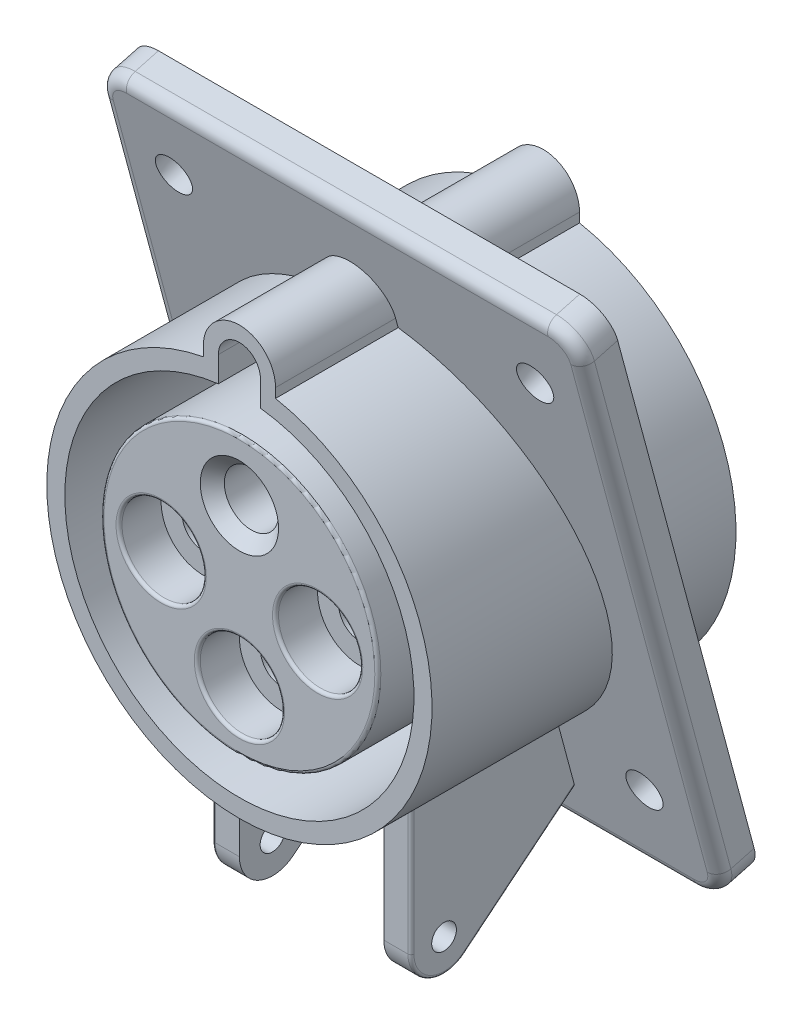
SolidWorks part; units mm, degrees
ref_plane "Спереди" through (0, 0, 0) normal (0, 0, 1) x (1, 0, 0)
ref_plane "Сверху" through (0, 0, 0) normal (0, 1, 0) x (1, 0, 0)
ref_plane "Справа" through (0, 0, 0) normal (1, 0, 0) x (0, 0, -1)
sketch "Эскиз1" plane through (0, 0, 0) normal (0, 0, 1) x (1, 0, 0)
  circle A0 centre (0, 0) radius 32
  dimension "D1" = 64
extrude "Бобышка-Вытянуть1" add sketch "Эскиз1" along normal blind 52
sketch "Эскиз2" plane through (0, 0, 52) normal (0, 0, 1) x (1, 0, 0)
  circle A0 centre (0, 0) radius 29
  dimension "D1" = 58
extrude "Вырез-Вытянуть1" cut sketch "Эскиз2" against normal blind 46
sketch "Эскиз3" plane through (0, 0, 0) normal (0, 0, -1) x (-1, 0, 0)
  circle A0 centre (0, 0) radius 24
  dimension "D1" = 48
extrude "Вырез-Вытянуть2" cut sketch "Эскиз3" against normal blind 46
sketch "Эскиз4" plane through (0, 0, 0) normal (0, 0, -1) x (-1, 0, 0)
  circle A0 centre (0, 0) radius 26
  circle A1 centre (0, 0) radius 48.7983
  dimension "D1" = 52
extrude "Вырез-Вытянуть3" cut sketch "Эскиз4" against normal blind 1.5
sketch "Эскиз5" plane through (0, 0, 52) normal (0, 0, 1) x (1, 0, 0)
  line L1 (-6, 33) -> (-6, 30.5387)
  line L2 (-6, 30.5387) -> (6, 30.5387)
  line L3 (6, 30.5387) -> (6, 33)
  arc A1 (6, 33) -> (-6, 33) centre (0, 33) ccw
  dimension "D1" = 12
extrude "Бобышка-Вытянуть2" add sketch "Эскиз5" against normal up to surface (50.5 mm away)
sketch "Эскиз6" plane through (0, 0, 52) normal (0, 0, 1) x (1, 0, 0)
  line L0 (-3.4963, 33) -> (-3.4963, 27.1224)
  line L1 (-3.4963, 27.1224) -> (3.4963, 27.1224)
  line L2 (3.4963, 27.1224) -> (3.4963, 33)
  arc A0 (3.4963, 33) -> (-3.4963, 33) centre (0, 33) ccw
extrude "Вырез-Вытянуть4" cut sketch "Эскиз6" against normal up to surface (46 mm away)
sketch "Эскиз7" plane through (0, 0, 0) normal (1, 0, 0) x (0, 0, -1)
  line L0 (-36.2467, 48.6283) -> (-30.4521, 50.1848)
  line L1 (-10.9858, -45.4163) -> (-5.1912, -43.8598)
  line L3 (-36.2467, 48.6283) -> (-10.9858, -45.4163)
  line L8 (-30.4521, 50.1848) -> (-5.1912, -43.8598)
extrude "Бобышка-Вытянуть3" add sketch "Эскиз7" along normal blind 40 and the other way blind 40
fillet "Скругление1" radius 5 4 edges at (40, -44.6381, 8.0885) (40, 49.4065, 33.3494) (-40, 49.4065, 33.3494) (-40, -44.6381, 8.0885)
sketch "Эскиз8" plane through (0, 0, 52) normal (0, 0, 1) x (1, 0, 0)
  line L0 (-3.4963, 33) -> (-3.4963, 28.7885)
  line L1 (3.4963, 33) -> (3.4963, 28.7885)
  arc A0 (-3.4963, 28.7885) -> (3.4963, 28.7885) centre (0, 0) ccw
  arc A1 (3.4963, 33) -> (-3.4963, 33) centre (0, 33) ccw
extrude "Вырез-Вытянуть5" cut sketch "Эскиз8" against normal blind 45
fillet "Скругление2" radius 2 8 edges at (-38.5355, 47.214, 35.8668) (0, 48.6283, 36.2467) (38.5355, 47.214, 35.8668) (40, 1.606, 23.6163) (38.5355, -44.002, 11.3657) (0, -45.4163, 10.9858) (-38.5355, -44.002, 11.3657) (-40, 1.606, 23.6163)
sketch "Эскиз9" plane through (0, -5.8085, 21.6247) normal (0, -0.2594, 0.9658) x (1, 0, 0)
  circle A0 centre (30, 43.3512) radius 3
  circle A1 centre (-30, 43.3512) radius 3
  circle A2 centre (-30, -26.6488) radius 3
  circle A3 centre (30, -26.6488) radius 3
extrude "Вырез-Вытянуть6" cut sketch "Эскиз9" against normal blind 40 draft 4
sketch "Эскиз10" plane through (0, 0, 1.5) normal (0, 0, -1) x (-1, 0, 0)
  circle A0 centre (0, 0) radius 23
extrude "Бобышка-Вытянуть4" add sketch "Эскиз10" against normal up to surface (50.5 mm away) separate body
sketch "Эскиз11" plane through (0, 0, 52) normal (0, 0, 1) x (1, 0, 0)
  circle A1 centre (0, 13) radius 4.5
  circle A2 centre (13, 0) radius 3.5
  circle A3 centre (-13, 0) radius 3.5
  circle A4 centre (0, -13) radius 3.5
  dimension "D2" = 9
  dimension "D3" = 7
  dimension "D4" = 7
  dimension "D5" = 7
extrude "Вырез-Вытянуть7" cut sketch "Эскиз11" against normal blind 47
sketch "Эскиз12" plane through (0, 0, 52) normal (0, 0, 1) x (1, 0, 0)
  circle A0 centre (0, -13) radius 7
  circle A1 centre (-13, 0) radius 7
  circle A2 centre (13, 0) radius 7
  dimension "D1" = 14
  dimension "D2" = 14
  dimension "D3" = 14
extrude "Вырез-Вытянуть8" cut sketch "Эскиз12" against normal blind 7
fillet "Скругление3" radius 0.5 3 edges at (20, 0, 52) (-6, 0, 52) (7, -13, 52)
chamfer "Фаска1" distance 2 angle 45 1 edges at (4.5, 13, 52)
fillet "Скругление4" radius 0.5 1 edges at (23, 0, 52)
sketch "Эскиз13" plane through (0, 0, 0) normal (1, 0, 0) x (0, 0, -1)
  line L0 (-40, -49.5) -> (-40, -25.2433)
  line L1 (-40, -25.2433) -> (-16.4044, -25.2433)
  line L2 (-12.2829, -40.5875) -> (-34.9497, 43.7995) construction
  line L3 (-16.4044, -25.2433) -> (-12.7448, -38.8676)
  line L4 (-12.7448, -38.8676) -> (-31.0257, -53.7637)
  arc A0 (-40, -49.5) -> (-31.0257, -53.7637) centre (-34.5, -49.5) ccw
  circle A1 centre (-34.5, -49.5) radius 2.0547
extrude "Бобышка-Вытянуть5" add sketch "Эскиз13" along normal blind 16.5 and the other way blind 16.5
sketch "Эскиз14" plane through (0, 0, 52) normal (0, 0, 1) x (1, 0, 0)
  line L0 (-15.4639, -24.533) -> (15.7926, -24.3227)
  arc A0 (-15.4639, -24.533) -> (15.7926, -24.3227) centre (0, 0) ccw
extrude "Вырез-Вытянуть9" cut sketch "Эскиз14" against normal up to surface (46 mm away)
sketch "Эскиз15" plane through (0, 0, 40) normal (0, 0, 1) x (1, 0, 0)
  line L0 (-12, -60.389) -> (12, -60.389)
  line L2 (12, -60.389) -> (12, -29.6648)
  line L3 (-12, -60.389) -> (-12, -29.6648)
  arc A0 (-12, -29.6648) -> (12, -29.6648) centre (0, 0) ccw
extrude "Вырез-Вытянуть10" cut sketch "Эскиз15" against normal blind 19.5
fillet "Скругление5" radius 0.5 6 edges at (-16.5, -46.3157, 21.8853) (-16.5, -54.4679, 36.8603) (16.5, -46.3157, 21.8853) (16.5, -54.4679, 36.8603) (-16.5, -38.459, 40) (16.5, -38.459, 40)
